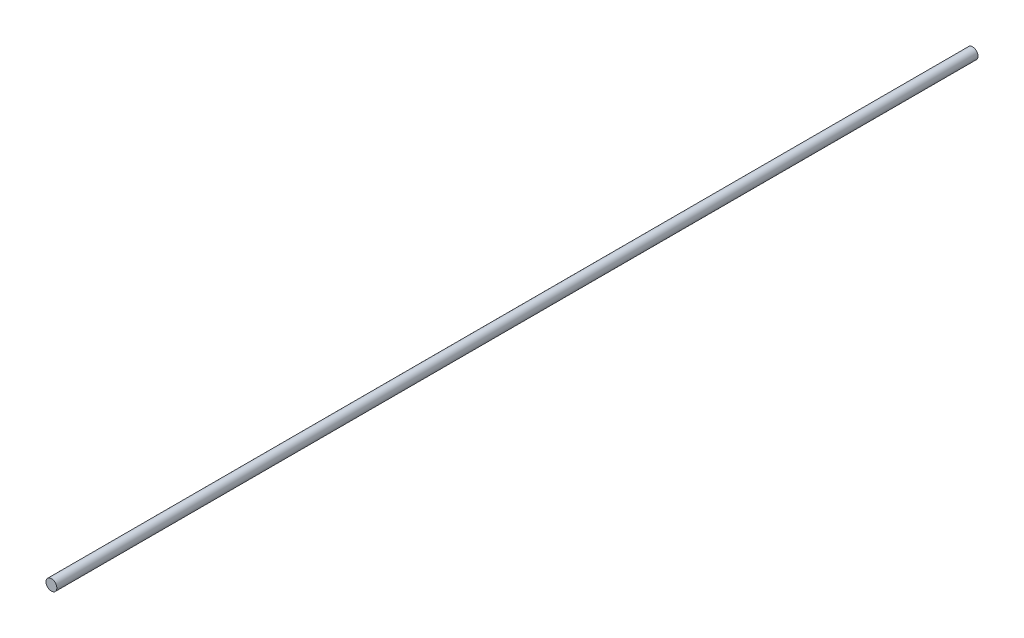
SolidWorks part; units mm, degrees
ref_plane "Front Plane" through (0, 0, 0) normal (0, 0, 1) x (1, 0, 0)
ref_plane "Top Plane" through (0, 0, 0) normal (0, 1, 0) x (1, 0, 0)
ref_plane "Right Plane" through (0, 0, 0) normal (1, 0, 0) x (0, 0, -1)
sketch "Sketch1" plane through (0, 0, 0) normal (0, 0, 1) x (1, 0, 0)
  circle A0 centre (0, 0) radius 30
  dimension "D1" = 60
extrude "Boss-Extrude1" add sketch "Sketch1" against normal blind 5100
